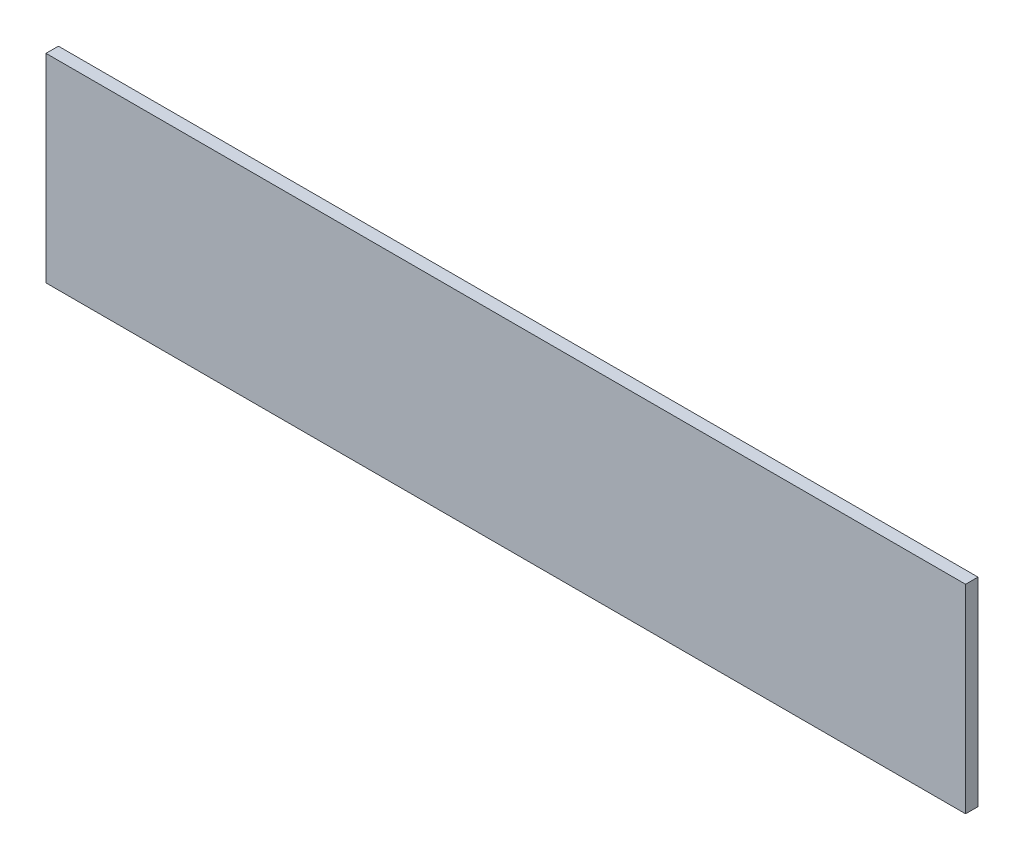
SolidWorks part; units mm, degrees
ref_plane "Alzado" through (0, 0, 0) normal (0, 0, 1) x (1, 0, 0)
ref_plane "Planta" through (0, 0, 0) normal (0, 1, 0) x (1, 0, 0)
ref_plane "Vista lateral" through (0, 0, 0) normal (1, 0, 0) x (0, 0, -1)
sketch "Sketch1" plane through (0, 0, 0) normal (0, 0, 1) x (1, 0, 0)
  line L1 (0, 0) -> (370, 0)
  line L2 (0, 0) -> (0, 80)
  line L3 (0, 80) -> (370, 80)
  line L4 (370, 0) -> (370, 80)
  dimension "D1" = 370
  dimension "D2" = 80
extrude "Boss-Extrude1" add sketch "Sketch1" along normal blind 5
